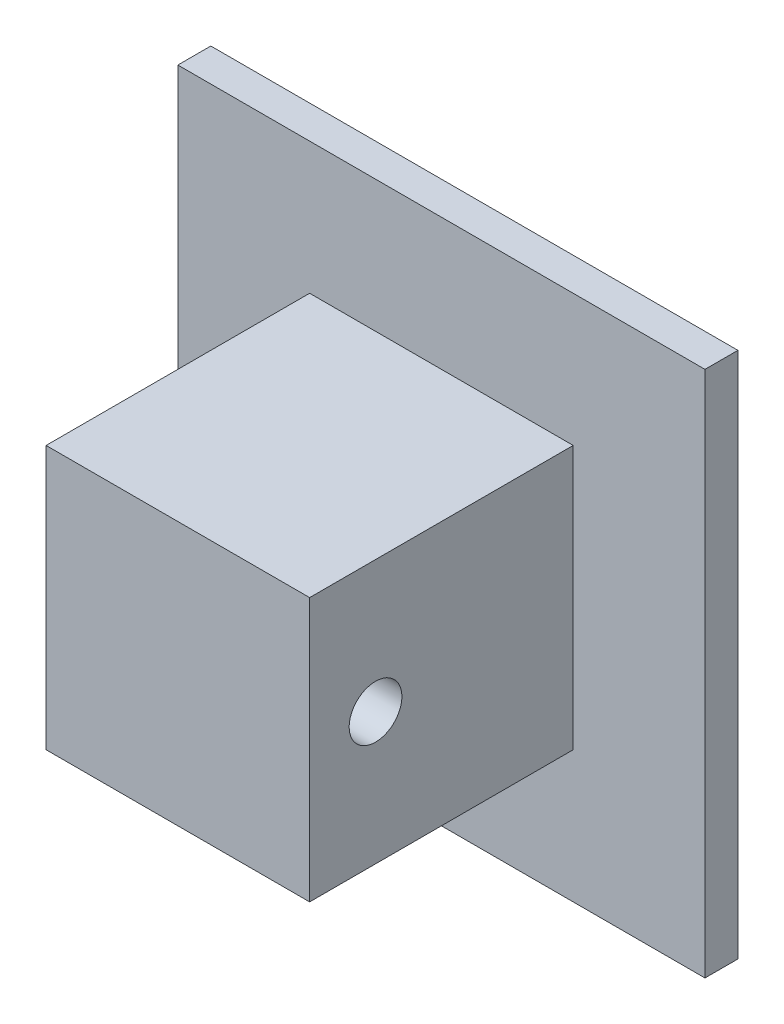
SolidWorks part; units mm, degrees
ref_plane "Plan1" through (0, 0, 0) normal (0, 0, 1) x (1, 0, 0)
ref_plane "Plan2" through (0, 0, 0) normal (0, 1, 0) x (1, 0, 0)
ref_plane "Plan3" through (0, 0, 0) normal (1, 0, 0) x (0, 0, -1)
sketch "Esquisse1" plane through (0, 0, 0) normal (0, 0, 1) x (1, 0, 0)
  line L1 (0, 0) -> (80, 0)
  line L2 (0, 0) -> (0, 80)
  line L3 (0, 80) -> (80, 80)
  line L4 (80, 0) -> (80, 80)
  dimension "D1" = 80
  dimension "D2" = 80
extrude "Extrusion1" add sketch "Esquisse1" along normal blind 5
sketch "Esquisse2" plane through (0, 0, 5) normal (0, 0, 1) x (1, 0, 0)
  line L0 (80, 80) -> (0, 80) construction
  line L1 (20, 60) -> (60, 60)
  line L2 (20, 60) -> (20, 20)
  line L3 (20, 20) -> (60, 20)
  line L4 (60, 60) -> (60, 20)
  line L5 (0, 80) -> (0, 0) construction
  line L6 (0, 0) -> (80, 0) construction
  line L7 (80, 0) -> (80, 80) construction
  dimension "D1" = 20
  dimension "D2" = 20
  dimension "D3" = 20
  dimension "D4" = 20
extrude "Extrusion2" add sketch "Esquisse2" along normal blind 40
sketch "Esquisse3" plane through (20, 0, 0) normal (-1, 0, 0) x (0, 0, 1)
  line L0 (45, 60) -> (5, 60) construction
  line L1 (45, 60) -> (45, 20) construction
  circle A0 centre (35, 40) radius 4
  dimension "D1" = 20
  dimension "D2" = 10
  dimension "D3" = 8
extrude "Enlèv. mat.-Extru.1" cut sketch "Esquisse3" against normal through all
